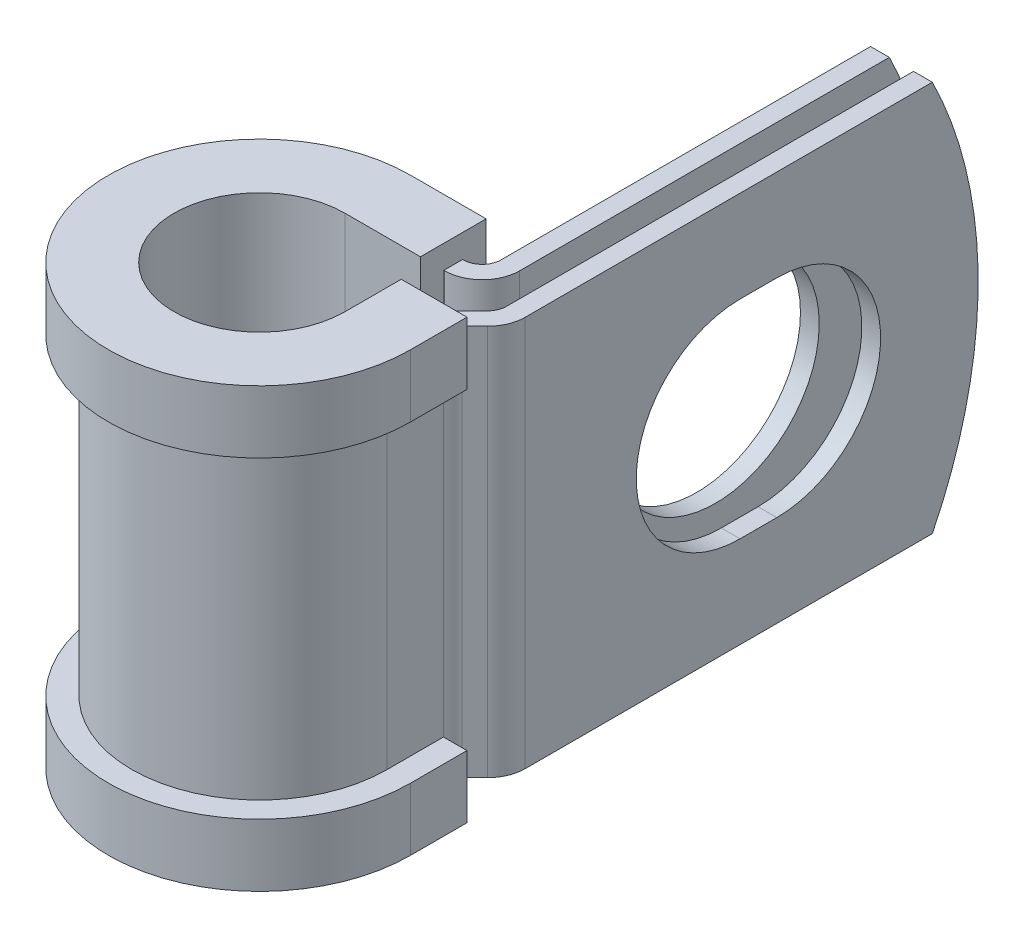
SolidWorks part; units mm, degrees
ref_plane "Front Plane" through (0, 0, 0) normal (0, 0, 1) x (1, 0, 0)
ref_plane "Top Plane" through (0, 0, 0) normal (0, 1, 0) x (1, 0, 0)
ref_plane "Right Plane" through (0, 0, 0) normal (1, 0, 0) x (0, 0, -1)
sketch "Sketch1" plane through (0, 0, 0) normal (0, 1, 0) x (1, 0, 0)
  line L0 (0, 7.0739) -> (4.9582, 7.0739)
  line L1 (7.0739, 0) -> (7.0739, 3.6614)
  line L2 (7.3966, 36.4998) -> (7.3966, 9.5123)
  line L3 (7.7881, 5.3856) -> (8.6143, 6.2118)
  line L5 (8.9714, 7.0739) -> (8.9714, 36.4998)
  arc A0 (0, 7.0739) -> (7.0739, 0) centre (0, 0) ccw
  arc A1 (7.7881, 5.3856) -> (7.0739, 3.6614) centre (9.5123, 3.6614) ccw
  arc A2 (8.6143, 6.2118) -> (8.9714, 7.0739) centre (7.7522, 7.0739) ccw
  arc A3 (4.9582, 7.0739) -> (7.3966, 9.5123) centre (4.9582, 9.5123) ccw
extrude "Extrude-Thin1" add sketch "Sketch1" along normal mid plane 25.4 thin
sketch "Sketch2" plane through (6.1774, 0, 0) normal (-1, 0, 0) x (0, 0, 1)
  line L0 (-36.4998, 12.7) -> (-36.4998, -12.7) construction
  line L1 (0, 12.7) -> (0, -12.7) construction
  circle A0 centre (-22.225, 0) radius 6.7437
  point P2 (-36.4998, 0)
extrude "Cut-Extrude1" cut sketch "Sketch2" against normal up to surface (1.2192 mm away)
sketch "Sketch3" plane through (10.1906, 0, 0) normal (1, 0, 0) x (0, 0, -1)
  line L0 (21.0312, 0) -> (23.4188, 0) construction
  line L1 (21.0312, 6.7437) -> (23.4188, 6.7437)
  line L2 (21.0312, -6.7437) -> (23.4188, -6.7437)
  line L3 (36.4998, 12.7) -> (36.4998, -12.7) construction
  arc A0 (21.0312, 6.7437) -> (21.0312, -6.7437) centre (21.0312, 0) ccw
  arc A1 (23.4188, -6.7437) -> (23.4188, 6.7437) centre (23.4188, 0) ccw
  point P3 (22.225, 0)
  point P8 (36.4998, 0)
  point P11 (14.2875, 0)
  point P12 (30.1625, 0)
extrude "Cut-Extrude2" cut sketch "Sketch3" against normal up to surface (1.2192 mm away)
sketch "Sketch4" plane through (6.1774, 0, 0) normal (-1, 0, 0) x (0, 0, 1)
  line L0 (-36.4998, 12.7) -> (-36.4998, -12.7)
  line L1 (-36.4998, 12.7) -> (-33.5225, 12.7)
  line L2 (-36.4998, 12.7) -> (-9.5123, 12.7) construction
  line L3 (-36.4998, -12.7) -> (-33.5225, -12.7)
  line L4 (-36.4998, -12.7) -> (-9.5123, -12.7) construction
  arc A0 (-33.5225, 12.7) -> (-33.5225, -12.7) centre (-7.9248, 0) ccw
extrude "Cut-Extrude3" cut sketch "Sketch4" against normal through all contours A0 M4 M5 | A0 L0 M2
ref_plane "Plane1" through (0, 0, -3.6614) normal (0, 0, -1) x (-1, 0, 0)
ref_plane "Plane2" through (4.9074, 0, 0) normal (-1, 0, 0) x (0, 0, 1)
sketch "Sketch5" plane through (0, 0, -3.6614) normal (0, 0, -1) x (-1, 0, 0)
  line L0 (-8.2931, 12.7) -> (-7.0739, 12.7)
  line L1 (-8.2931, 12.7) -> (-8.2931, -12.7) construction
  line L3 (-7.0739, 12.7) -> (-7.0739, -12.7)
  line L4 (-7.0739, -12.7) -> (-8.2931, -12.7)
  line L5 (-8.2931, -12.7) -> (-8.2931, -10.16)
  line L6 (-8.2931, 12.7) -> (-8.2931, 10.16)
  line L7 (-9.8171, 14.224) -> (-9.8171, 10.16)
  line L8 (-9.8171, 14.224) -> (-5.5499, 14.224)
  line L9 (-5.5499, 14.224) -> (-5.5499, -14.224)
  line L10 (-5.5499, -14.224) -> (-9.8171, -14.224)
  line L11 (-9.8171, -14.224) -> (-9.8171, -10.16)
  line L12 (-9.8171, 10.16) -> (-8.2931, 10.16)
  line L13 (-8.2931, -10.16) -> (-9.8171, -10.16)
sketch "Sketch6" plane through (0, 12.7, 0) normal (0, 1, 0) x (1, 0, 0)
  line L0 (5.5499, 0) -> (5.5499, 3.6614)
  line L1 (5.5499, 3.6614) -> (9.8171, 3.6614) construction
  line L2 (4.9074, 6.9878) -> (4.9074, -6.9878) construction
  line L5 (0, 5.5499) -> (4.9074, 5.5499)
  arc A0 (0, 5.5499) -> (5.5499, 0) centre (0, 0) ccw
sweep "Sweep1" add profiles "Sketch5" path "Sketch6"
equation "\"D4@Sketch5\" = \"D1@Extrude-Thin1\""
equation "\"D5@Sketch5\" = \"D5@Extrude-Thin1\""
equation "\"D1@Sketch3\" = \"D2@Sketch2\""
equation "\"D7@Sketch1\" = \"D3@Sketch2\" + \"D1@Sketch3\""
equation "\"D1@Sketch1\" = \"D1@Sketch6\" + 2 * \"D3@Sketch5\""
equation "\"D1@Sketch4\" = ( \"D1@Extrude-Thin1\" + .125 ) * 2"
equation "\"D9@Sketch1\"= \"D5@Extrude-Thin1\""
equation "\"D8@Sketch1\"= 2 * \"D5@Extrude-Thin1\""
equation "\"D2@Sketch1\" = 2 * \"D5@Extrude-Thin1\""
equation "\"D2@Sketch3\" = \"D1@Sketch2\""
